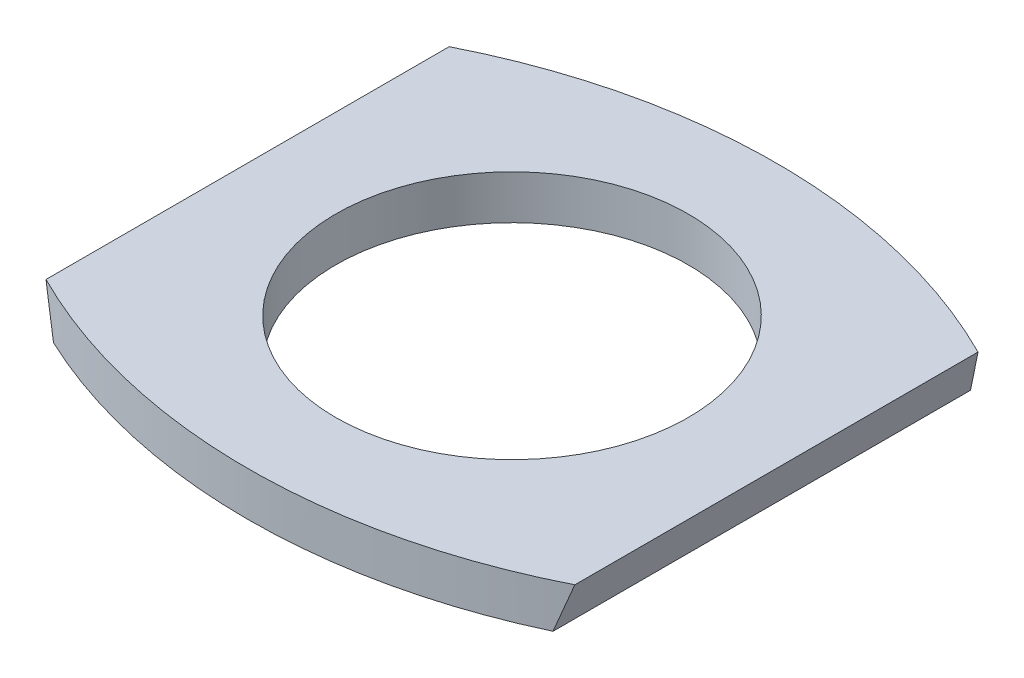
SolidWorks part; units mm, degrees
ref_plane "Front Plane" through (0, 0, 0) normal (0, 0, 1) x (1, 0, 0)
ref_plane "Top Plane" through (0, 0, 0) normal (0, 1, 0) x (1, 0, 0)
ref_plane "Right Plane" through (0, 0, 0) normal (1, 0, 0) x (0, 0, -1)
sketch "Sketch1" plane through (0, 0, 0) normal (0, 1, 0) x (1, 0, 0)
  line L0 (0, 50.2453) -> (0, -74.8754) construction
  line L1 (-18, 13.7211) -> (-18, -13.7211)
  line L2 (18, 13.7211) -> (18, -13.7211)
  line L3 (-60.0973, 0) -> (64.5307, 0) construction
  line L4 (-18, 50.2453) -> (-18, -74.8754) construction
  line L5 (18, 50.2453) -> (18, -74.8754) construction
  circle A0 centre (0, 0) radius 12
  arc A1 (-18, -13.7211) -> (18, -13.7211) centre (0, 22) ccw
  arc A2 (18, 13.7211) -> (-18, 13.7211) centre (0, -22) ccw
  dimension "D1" = 24
  dimension "D4" = 80
  dimension "D5" = 22
  dimension "D6" = 22
  dimension "D7" = 40
  dimension "D2" = 18
  dimension "D3" = 18
extrude "Extrude1" add sketch "Sketch1" along normal blind 3
chamfer "Chamfer1" distance 1 distance2 3 2 edges at (-18, 0, 0) (18, 0, 0)
